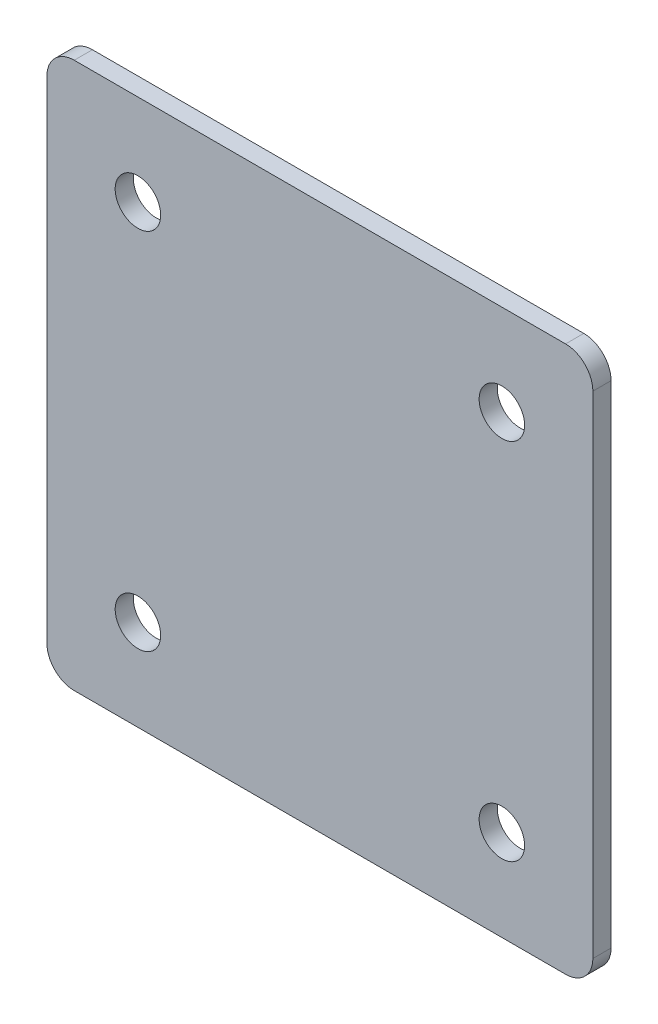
SolidWorks part; units mm, degrees
ref_plane "Plan_Face" through (0, 0, 0) normal (0, 0, 1) x (1, 0, 0)
ref_plane "Plan_Dessus" through (0, 0, 0) normal (0, 1, 0) x (1, 0, 0)
ref_plane "Plan_Droite" through (0, 0, 0) normal (1, 0, 0) x (0, 0, -1)
sketch "Esquisse1" plane through (0, 0, 0) normal (0, 0, 1) x (1, 0, 0)
  line L1 (-60, 60) -> (60, 60)
  line L2 (-60, 60) -> (-60, -60)
  line L3 (-60, -60) -> (60, -60)
  line L4 (60, 60) -> (60, -60)
  line L5 (-60, 60) -> (60, -60) construction
  line L6 (-60, -60) -> (60, 60) construction
  point P0 (0, 0)
  dimension "D1" = 120
extrude "Extrusion1" add sketch "Esquisse1" along normal blind 4
fillet "Congé1" radius 6 4 edges at (-60, -60, 2) (60, -60, 2) (60, 60, 2) (-60, 60, 2)
sketch "Esquisse2" plane through (0, 0, 4) normal (0, 0, 1) x (1, 0, 0)
  line L1 (-40, 40) -> (40, 40) construction
  line L2 (-40, 40) -> (-40, -40) construction
  line L3 (-40, -40) -> (40, -40) construction
  line L4 (40, 40) -> (40, -40) construction
  line L5 (-40, 40) -> (40, -40) construction
  line L6 (-40, -40) -> (40, 40) construction
  circle A0 centre (-40, 40) radius 5
  circle A1 centre (40, 40) radius 5
  circle A2 centre (-40, -40) radius 5
  circle A3 centre (40, -40) radius 5
  point P0 (0, 0)
  dimension "D2" = 10
  dimension "D3" = 10
  dimension "D4" = 10
  dimension "D5" = 10
  dimension "D1" = 80
extrude "Extrusion2" cut sketch "Esquisse2" against normal through all
